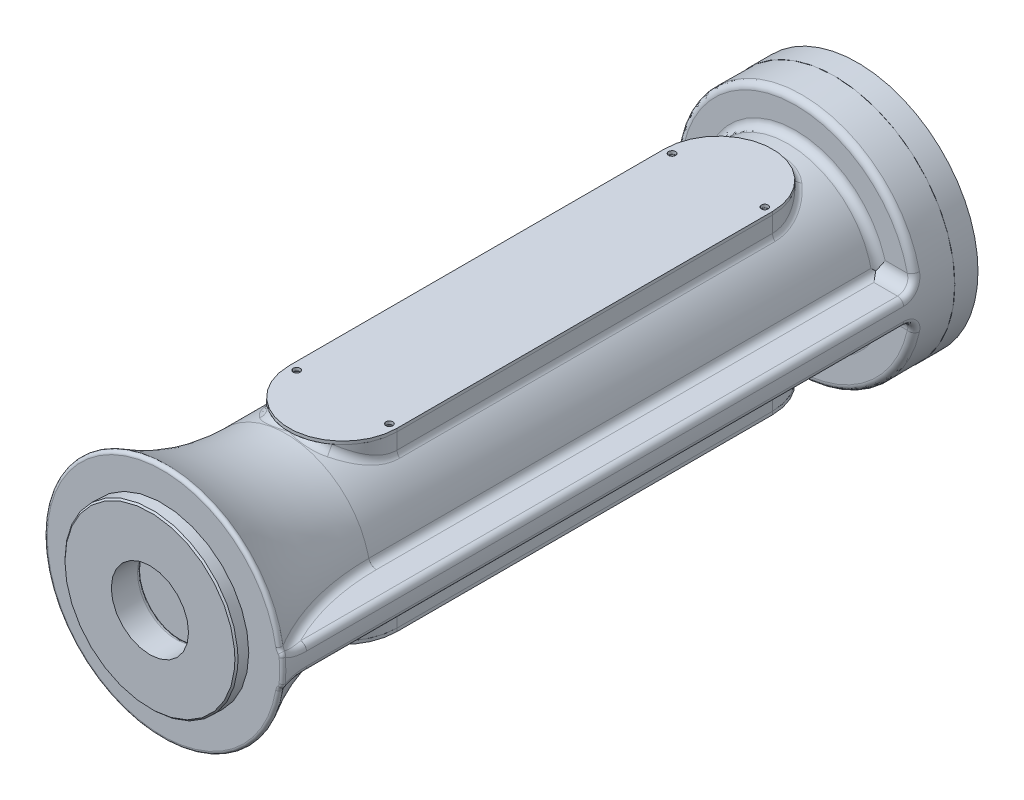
SolidWorks part; units mm, degrees
ref_plane "前视基准面" through (0, 0, 0) normal (0, 0, 1) x (1, 0, 0)
ref_plane "上视基准面" through (0, 0, 0) normal (0, 1, 0) x (1, 0, 0)
ref_plane "右视基准面" through (0, 0, 0) normal (1, 0, 0) x (0, 0, -1)
imported_body "输入1"
imported_body "输入2"
imported_body "输入3"
imported_body "输入4"
sketch "草图1" plane through (0, 0, -442.731) normal (0, 0, -1) x (-1, 0, 0)
  circle A1 centre (0, 0) radius 56
  circle A2 centre (0, 0) radius 56
  dimension "D1" = 0
extrude "凸台-拉伸1" add sketch "草图1" against normal up to surface (15 mm away) separate body
